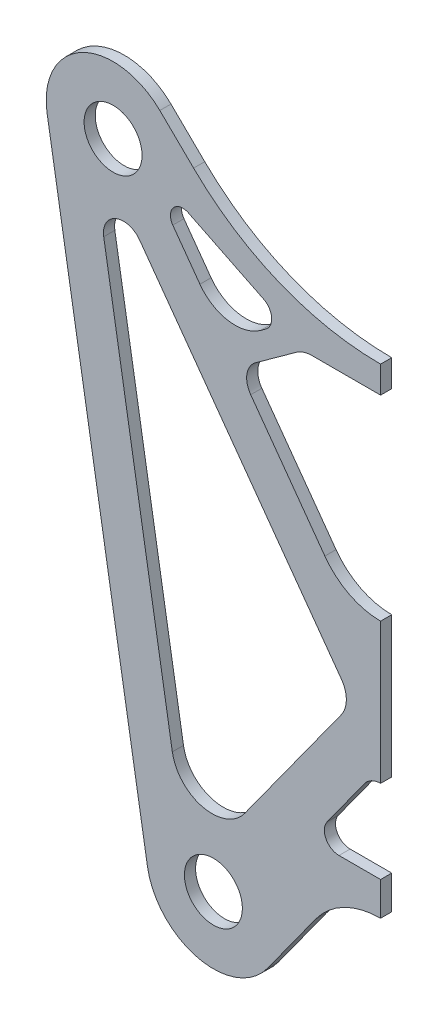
SolidWorks part; units mm, degrees
ref_plane "Ebene vorne" through (0, 0, 0) normal (0, 0, 1) x (1, 0, 0)
ref_plane "Ebene oben" through (0, 0, 0) normal (0, 1, 0) x (1, 0, 0)
ref_plane "Ebene rechts" through (0, 0, 0) normal (1, 0, 0) x (0, 0, -1)
sketch "Skizze1" plane through (0, 0, 0) normal (0, 0, 1) x (1, 0, 0)
  line L0 (-68.9175, 95.7966) -> (-68.9175, -338.76) construction
  line L1 (-68.9175, 5.0581) -> (-68.9175, -7.0047)
  line L2 (-167.9421, 54.0711) -> (-152.7893, 39.2524)
  line L3 (-119.5971, -254.942) -> (-98.0453, -225.1011)
  line L4 (-68.9175, -7.0047) -> (-93.9175, -7.0047)
  line L5 (-68.9175, -7.0047) -> (-93.9175, -7.0047) construction
  line L6 (-93.9175, -7.0047) -> (-99.7671, -7.0047)
  line L7 (-194.6863, 40.6103) -> (0.3137, -229.3897) construction
  line L8 (-131.745, -220.5231) -> (-95.4694, -170.2953) construction
  line L9 (-68.9175, -82.0047) -> (-93.9175, -82.0047) construction
  line L10 (-93.9175, -7.0047) -> (-93.9175, -82.0047) construction
  line L11 (-155.1679, 20.7087) -> (-121.4438, 4.0994)
  line L12 (51.0825, 32.6227) -> (-143.9175, -237.3773) construction
  line L13 (6.0825, -237.3773) -> (-188.9175, 32.6227) construction
  line L14 (-86.5305, -126.0548) -> (-176.9761, -0.8225)
  line L15 (-129.8343, -199.8834) -> (-86.5305, -139.9244)
  line L16 (-193.1229, -7.5603) -> (-162.3385, -192.267)
  line L17 (-173.5093, -242.3092) -> (-218.5093, 27.6908)
  line L18 (-120.4979, -7.1452) -> (-122.787, -8.7985)
  line L19 (-149.9532, -4.4168) -> (-162.1394, 12.4564)
  line L20 (-197.3611, 4.2085) -> (-158.8652, -226.7665) construction
  line L21 (-106.7128, -9.2507) -> (-124.9982, -22.4568)
  line L22 (-127.1754, -35.9553) -> (-93.9175, -82.0047)
  line L23 (51.0825, 32.6227) -> (63.255, 49.4769) construction
  line L24 (-162.8882, 37.5797) -> (-112.253, 12.6417) construction
  line L25 (-153.8826, 1.0239) -> (-114.4011, -53.6428) construction
  line L26 (-76.1282, -161.5092) -> (-92.9022, -184.7349)
  line L27 (-87.5764, -195.1509) -> (-68.9175, -195.1509)
  line L28 (-82.0498, -169.7084) -> (-89.8184, -180.465) construction
  line L29 (-68.9175, -133.5311) -> (-62.8107, -125.0756) construction
  line L30 (-68.9175, -94.7875) -> (-68.9175, -157.8223)
  line L31 (-68.9175, -195.1509) -> (-68.9175, -210.2077)
  circle A0 centre (-188.9175, 32.6227) radius 13
  arc A1 (-119.5971, -254.942) -> (-173.5093, -242.3092) centre (-143.9175, -237.3773) cw
  circle A2 centre (-143.9175, -237.3773) radius 13
  arc A3 (-218.5093, 27.6908) -> (-167.9421, 54.0711) centre (-188.9175, 32.6227) cw
  arc A4 (-152.7893, 39.2524) -> (-68.9175, 5.0581) centre (-68.9175, 125.0155) ccw
  arc A5 (-98.0453, -225.1011) -> (-68.9175, -210.2077) centre (-68.9175, -246.1378) cw
  arc A6 (-99.7671, -7.0047) -> (-106.7128, -9.2507) centre (-99.7671, -18.8678) ccw
  arc A7 (-124.9982, -22.4568) -> (-127.1754, -35.9553) centre (-119.3376, -30.2946) ccw
  arc A8 (-121.4438, 4.0994) -> (-120.4979, -7.1452) centre (-124.353, -1.8074) cw
  arc A9 (-122.787, -8.7985) -> (-149.9532, -4.4168) centre (-134.1793, 6.9754) cw
  arc A10 (-162.1394, 12.4564) -> (-155.1679, 20.7087) centre (-157.6271, 15.7153) cw
  circle A11 centre (-188.9175, 32.6227) radius 30 construction
  circle A12 centre (-143.9175, -237.3773) radius 30 construction
  arc A13 (-86.5305, -139.9244) -> (-86.5305, -126.0548) centre (-96.1326, -132.9896) ccw
  arc A14 (-162.3385, -192.267) -> (-129.8343, -199.8834) centre (-144.4973, -189.2935) ccw
  arc A15 (-176.9761, -0.8225) -> (-193.1229, -7.5603) centre (-184.2601, -6.0831) ccw
  arc A17 (-93.9175, -82.0047) -> (-68.9175, -94.7875) centre (-68.9175, -63.9492) ccw
  circle A18 centre (-140.5608, -34.3327) radius 9.9012 construction
  arc A19 (-92.9022, -184.7349) -> (-87.5764, -195.1509) centre (-87.5764, -188.5813) ccw
  arc A20 (-76.1282, -161.5092) -> (-68.9175, -157.8223) centre (-68.9175, -166.717) cw
  circle A21 centre (-101.6377, -178.8361) radius 10.5354 construction
  point P51 (-206.4822, 56.9431)
  point P52 (-161.4822, -261.6977)
  point P55 (-156.638, -210.2077)
  point P57 (-161.0894, 21.4157)
  point P60 (-188.9175, 45.6227)
  point P62 (-143.9175, -250.3773)
  dimension "D7" = 30
  dimension "D4" = 25
  dimension "D1" = 120
  dimension "D2" = 75
  dimension "D3" = 270
  dimension "D5" = 75
  dimension "D6" = 30
  dimension "D8" = 13
  dimension "D9" = 13
extrude "Aufsatz-Linear austragen1" add sketch "Skizze1" along normal blind 5
ref_plane "Ebene1" through (2.774, 0, 0) normal (1, 0, 0) x (0, 0, -1)
